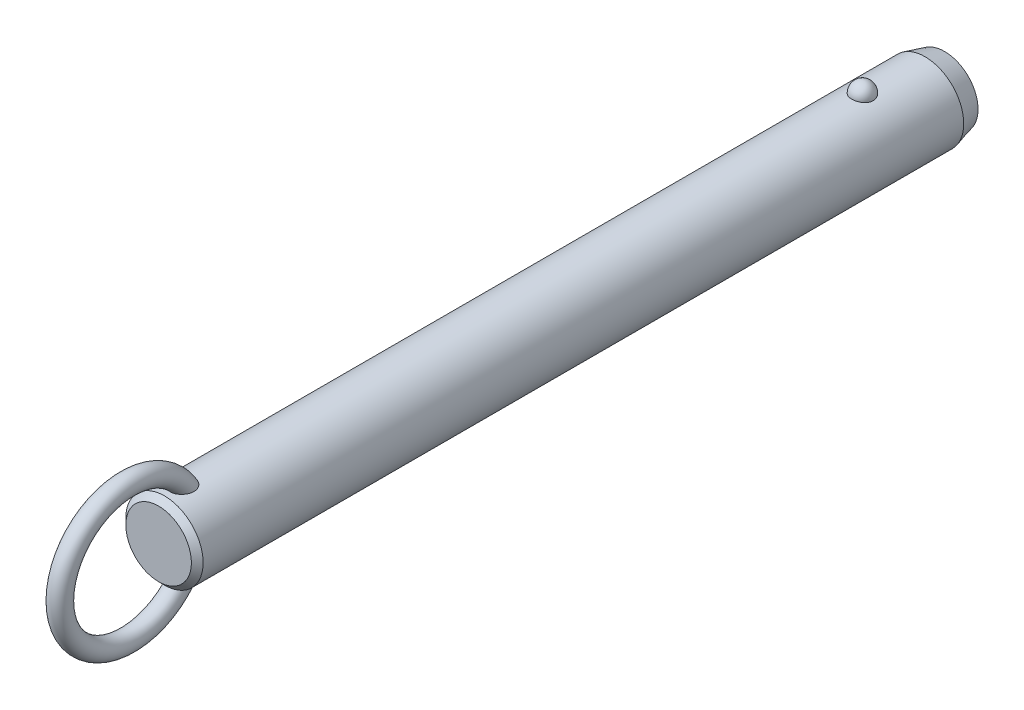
SolidWorks part; units mm, degrees
ref_plane "Front Plane" through (0, 0, 0) normal (0, 0, 1) x (1, 0, 0)
ref_plane "Top Plane" through (0, 0, 0) normal (0, 1, 0) x (1, 0, 0)
ref_plane "Right Plane" through (0, 0, 0) normal (1, 0, 0) x (0, 0, -1)
sketch "Sketch2" plane through (0, 0, 0) normal (0, 0, 1) x (1, 0, 0)
  circle A0 centre (0, 0) radius 7.9
  point P3 (0, 7.9)
  dimension "D1" = 15.8
extrude "Boss-Extrude1" add sketch "Sketch2" along normal blind 132.1
sketch "Sketch3" plane through (0, 0, 0) normal (0, 0, -1) x (-1, 0, 0)
  circle A0 centre (0, 0) radius 7.9
  dimension "D1" = 15.8
extrude "Boss-Extrude2" add sketch "Sketch3" along normal blind 19
chamfer "Chamfer1" distance 4 angle 15 1 edges at (-7.9, 0, -19)
sketch "Sketch12" plane through (0, 0, 0) normal (1, 0, 0) x (0, 0, -1)
  line L0 (-132.1, 7.9) -> (-132.1, -7.9) construction
  point P0 (-132.1, 0)
sketch "Sketch13" plane through (0, 0, 0) normal (1, 0, 0) x (0, 0, -1)
  circle A0 centre (-147.95, 0) radius 15.85
  point P2 (-132.1, 0)
  dimension "D1" = 31.7
sketch "Sketch14" plane through (0, 0, 0) normal (0, 1, 0) x (1, 0, 0)
  circle A0 centre (0, -134.1) radius 2
  point P2 (0, -132.1)
  dimension "D1" = 4
sweep "Sweep1" add profiles "Sketch14" path "Sketch13"
sketch "Sketch15" plane through (0, 0, 132.1) normal (0, 0, 1) x (1, 0, 0)
  circle A0 centre (0, 0) radius 7.9
  dimension "D1" = 15.8
extrude "Boss-Extrude3" add sketch "Sketch15" along normal blind 9.52
chamfer "Chamfer2" distance 1.2 angle 45 1 edges at (7.9, 0, 141.62)
sketch "Sketch18" plane through (0, 0, 0) normal (1, 0, 0) x (0, 0, -1)
  line L0 (15, 7.9) -> (-134.2091, 7.9) construction
  line L1 (2.2, 10.1) -> (2.2, 5.7)
  line L2 (-134.2091, -7.9) -> (15, -7.9) construction
  arc A0 (2.2, 10.1) -> (2.2, 5.7) centre (2.2, 7.9) ccw
  point P4 (0, 7.9)
  dimension "D1" = 18
revolve "Revolve1" add sketch "Sketch18" angle 360 about L1
